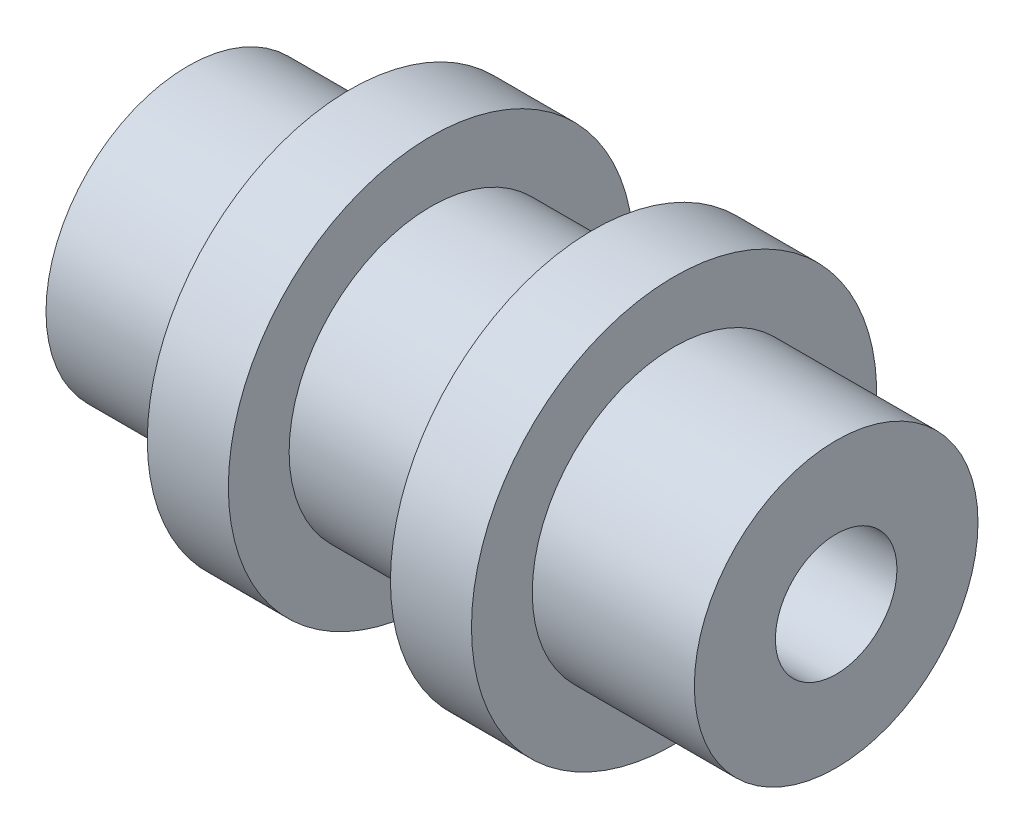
SolidWorks part; units mm, degrees
ref_plane "Front" through (0, 0, 0) normal (0, 0, 1) x (1, 0, 0)
ref_plane "Top" through (0, 0, 0) normal (0, 1, 0) x (1, 0, 0)
ref_plane "Right" through (0, 0, 0) normal (1, 0, 0) x (0, 0, -1)
sketch "Sketch1" plane through (0, 0, 0) normal (0, 1, 0) x (1, 0, 0)
  line L0 (-16, 0) -> (16, 0)
  line L1 (16, 0) -> (16, 7)
  line L2 (16, 7) -> (8, 7)
  line L3 (8, 7) -> (8, 10)
  line L4 (8, 10) -> (4, 10)
  line L5 (4, 10) -> (4, 7)
  line L6 (4, 7) -> (-4, 7)
  line L8 (-4, 10) -> (-4, 7)
  line L9 (-8, 10) -> (-4, 10)
  line L10 (-8, 7) -> (-8, 10)
  line L11 (-16, 7) -> (-8, 7)
  line L12 (-16, 0) -> (-16, 7)
revolve "Revolve1" add sketch "Sketch1" angle 360 about L0
sketch "Sketch2" plane through (16, 0, 0) normal (1, 0, 0) x (0, 0, -1)
  circle A0 centre (0, 0) radius 3
extrude "Cut-Extrude1" cut sketch "Sketch2" against normal through all
